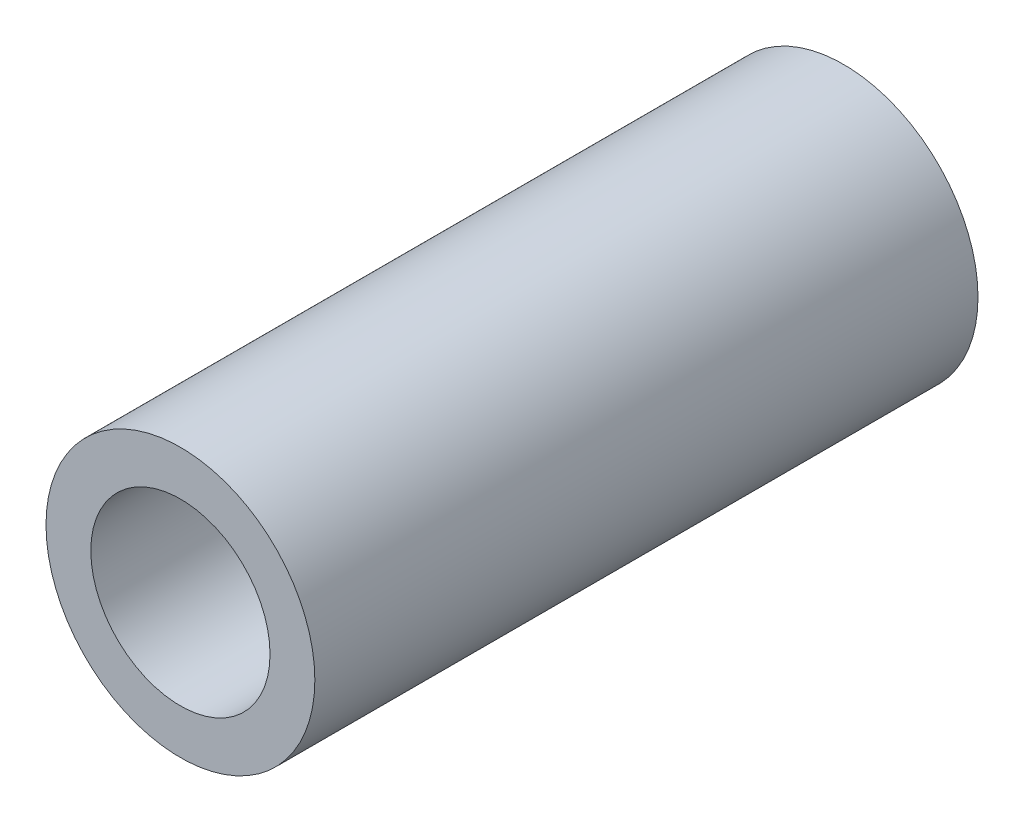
SolidWorks part; units mm, degrees
ref_plane "前视基准面" through (0, 0, 0) normal (0, 0, 1) x (1, 0, 0)
ref_plane "上视基准面" through (0, 0, 0) normal (0, 1, 0) x (1, 0, 0)
ref_plane "右视基准面" through (0, 0, 0) normal (1, 0, 0) x (0, 0, -1)
sketch "草图1" plane through (0, 0, 0) normal (0, 0, 1) x (1, 0, 0)
  circle A0 centre (0, 0) radius 2
  circle A1 centre (0, 0) radius 3
  dimension "D1" = 4
  dimension "D2" = 6
extrude "凸台-拉伸1" add sketch "草图1" along normal blind 14.8
